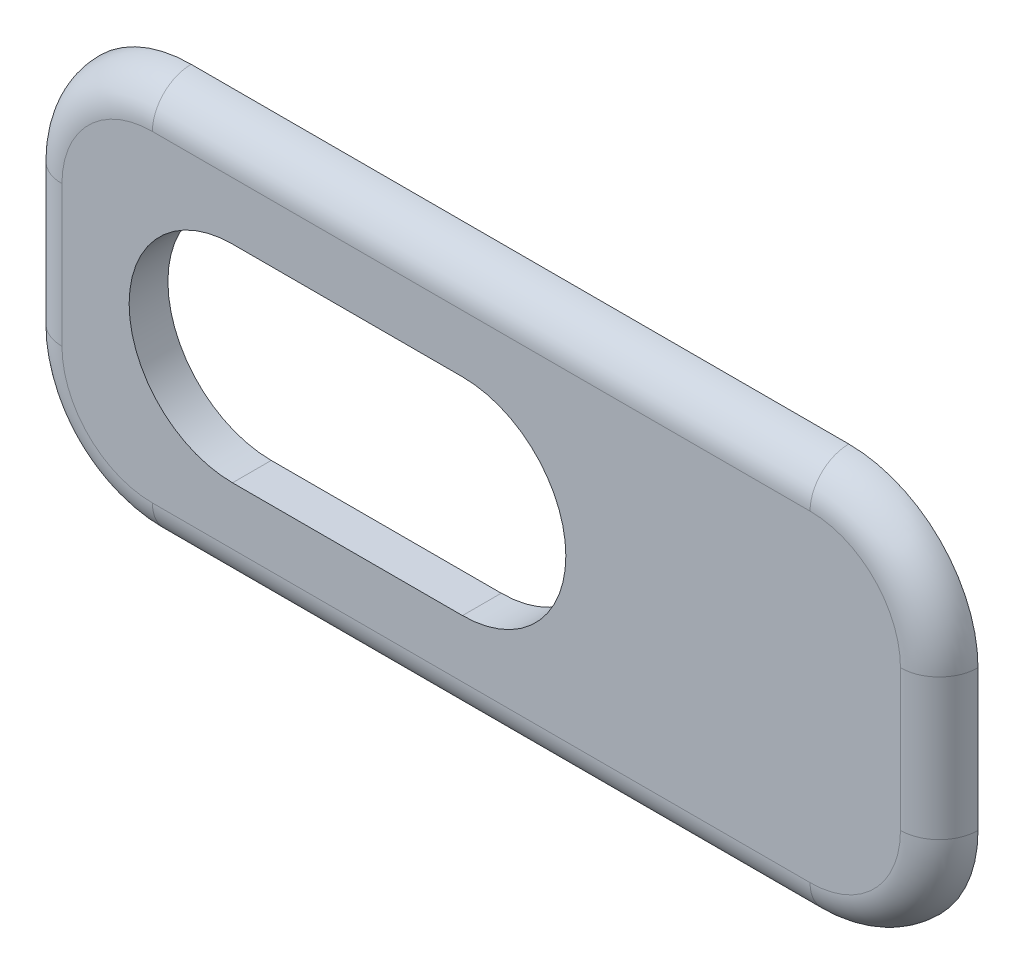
SolidWorks part; units mm, degrees
ref_plane "Front Plane" through (0, 0, 0) normal (0, 0, 1) x (1, 0, 0)
ref_plane "Top Plane" through (0, 0, 0) normal (0, 1, 0) x (1, 0, 0)
ref_plane "Right Plane" through (0, 0, 0) normal (1, 0, 0) x (0, 0, -1)
sketch "Sketch2" plane through (0, 0, 0) normal (0, 0, 1) x (1, 0, 0)
  line L1 (-25.45, 15.45) -> (25.45, 15.45)
  line L2 (-35.45, 5.45) -> (-35.45, -5.45)
  line L3 (-25.45, -15.45) -> (25.45, -15.45)
  line L4 (35.45, 5.45) -> (35.45, -5.45)
  line L5 (-35.45, 15.45) -> (35.45, -15.45) construction
  line L6 (-35.45, -15.45) -> (35.45, 15.45) construction
  arc A0 (-35.45, -5.45) -> (-25.45, -15.45) centre (-25.45, -5.45) ccw
  arc A1 (25.45, -15.45) -> (35.45, -5.45) centre (25.45, -5.45) ccw
  arc A2 (35.45, 5.45) -> (25.45, 15.45) centre (25.45, 5.45) ccw
  arc A3 (-25.45, 15.45) -> (-35.45, 5.45) centre (-25.45, 5.45) ccw
  point P0 (0, 0)
  point P6 (0, 15.45)
  point P7 (-35.45, 0)
  point P8 (0, -15.45)
  point P9 (35.45, 0)
  dimension "D3" = 10
  dimension "D1" = 70.9
  dimension "D2" = 30.9
extrude "Boss-Extrude1" add sketch "Sketch2" along normal mid plane 3
fillet "Fillet1" radius 3 8 edges at (32.5211, 12.5211, 1.5) (35.45, 0, 1.5) (32.5211, -12.5211, 1.5) (0, -15.45, 1.5) (-32.5211, -12.5211, 1.5) (-35.45, 0, 1.5) (-32.5211, 12.5211, 1.5) (0, 15.45, 1.5)
sketch "Sketch3" plane through (0, 0, 1.5) normal (0, 0, 1) x (1, 0, 0)
  line L0 (-19.25, 0) -> (-1.45, 0) construction
  line L1 (-19.25, 8) -> (-1.45, 8)
  line L2 (-19.25, -8) -> (-1.45, -8)
  line L3 (-35.45, 5.45) -> (-35.45, -5.45) construction
  arc A0 (-19.25, 8) -> (-19.25, -8) centre (-19.25, 0) ccw
  arc A1 (-1.45, -8) -> (-1.45, 8) centre (-1.45, 0) ccw
  point P3 (-10.35, 0)
  dimension "D2" = 17.8
  dimension "D3" = 16.2
  dimension "D1" = 16
extrude "Cut-Extrude1" cut sketch "Sketch3" against normal blind 3
